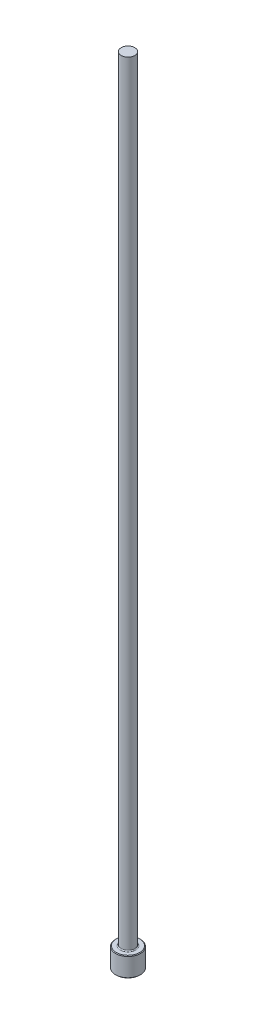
SolidWorks part; units mm, degrees
ref_plane "Front Plane" through (0, 0, 0) normal (0, 0, 1) x (1, 0, 0)
ref_plane "Top Plane" through (0, 0, 0) normal (0, 1, 0) x (1, 0, 0)
ref_plane "Right Plane" through (0, 0, 0) normal (1, 0, 0) x (0, 0, -1)
other "Configuration Table"
sketch "Sketch1" plane through (0, 0, 0) normal (0, 0, 1) x (1, 0, 0)
  line L0 (0, 259.9588) -> (0, -15.1925) construction
  line L1 (0, 0) -> (-0.9906, 0)
  line L2 (-0.9906, 0) -> (-0.9906, 1.5748)
  line L3 (-0.9906, 1.5748) -> (-0.5461, 1.5748)
  line L4 (-0.5461, 1.5748) -> (-0.5461, 63.5)
  line L5 (-0.5461, 63.5) -> (0, 63.5)
  line L6 (0, 63.5) -> (0, 0)
  dimension "L" = 63.5
  dimension "H" = 1.9812
  dimension "T" = 1.5748
  dimension "D" = 1.0922
revolve "Revolve1" add sketch "Sketch1" angle 360 about L0
chamfer "Chamfer1" distance 0.0508 angle 45 2 edges at (0, 1.5748, 0.9906) (0, 0, 0.9906)
fillet "Fillet1" radius 0.0762 1 edges at (0, 1.5748, 0.5461)
